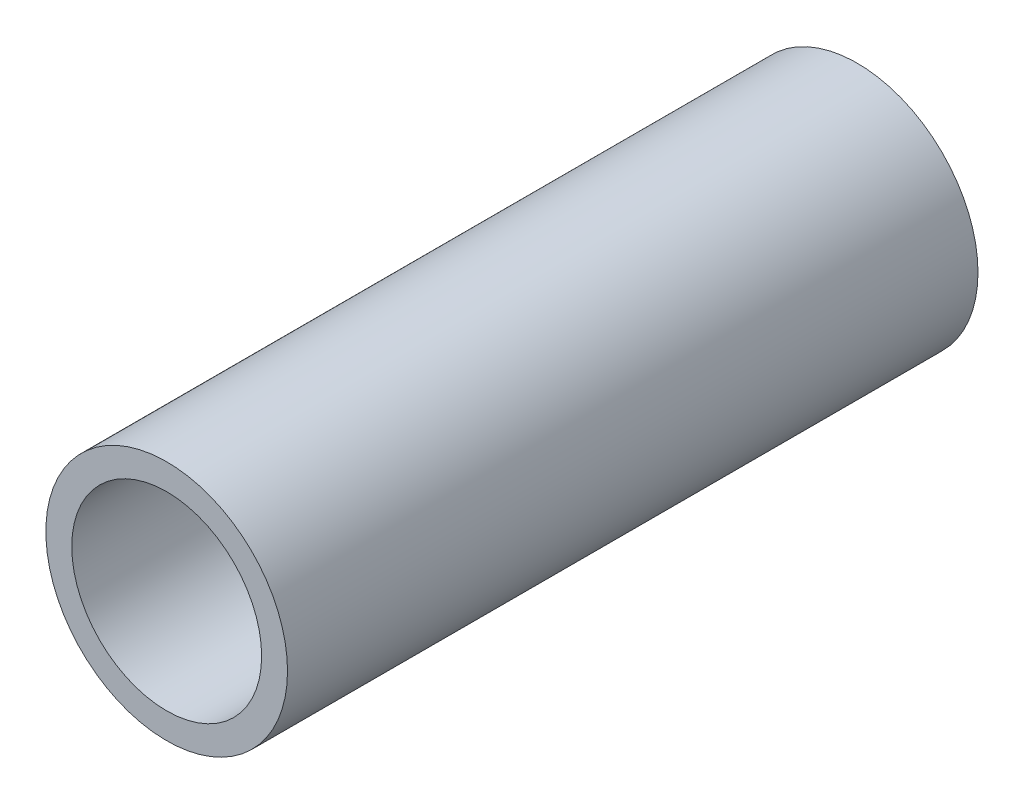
SolidWorks part; units mm, degrees
ref_plane "Plan de face" through (0, 0, 0) normal (0, 0, 1) x (1, 0, 0)
ref_plane "Plan de dessus" through (0, 0, 0) normal (0, 1, 0) x (1, 0, 0)
ref_plane "Plan de droite" through (0, 0, 0) normal (1, 0, 0) x (0, 0, -1)
sketch "Esquisse1" plane through (0, 0, 0) normal (0, 0, 1) x (1, 0, 0)
  circle A0 centre (0, 0) radius 11
  circle A1 centre (0, 0) radius 14
  dimension "D2" = 28
  dimension "D1" = 3
extrude "Extrusion1" add sketch "Esquisse1" along normal blind 80
